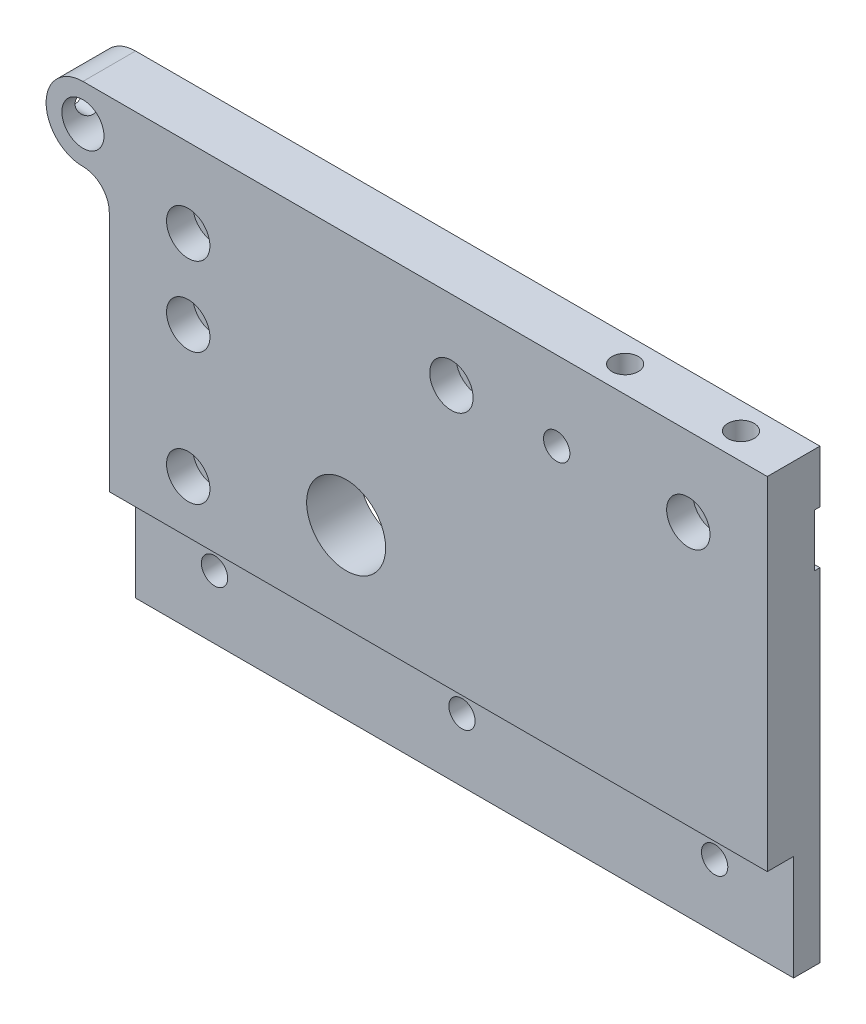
SolidWorks part; units mm, degrees
ref_plane "Front Plane" through (0, 0, 0) normal (0, 0, 1) x (1, 0, 0)
ref_plane "Top Plane" through (0, 0, 0) normal (0, 1, 0) x (1, 0, 0)
ref_plane "Right Plane" through (0, 0, 0) normal (1, 0, 0) x (0, 0, -1)
sketch "Sketch1" plane through (0, 0, 0) normal (0, 0, 1) x (1, 0, 0)
  line L0 (-743.1243, 0) -> (36413.0918, 0) construction
  line L1 (0, -743.1243) -> (0, 36413.0918) construction
  line L3 (-85.725, 53.975) -> (79.375, 53.975)
  line L4 (-79.375, 29.845) -> (-79.375, -53.975)
  line L5 (-79.375, -53.975) -> (79.375, -53.975)
  line L6 (79.375, 53.975) -> (79.375, -53.975)
  arc A0 (-85.725, 53.975) -> (-85.725, 36.195) centre (-85.725, 45.085) ccw
  circle A1 centre (-85.725, 45.085) radius 5.08
  arc A2 (-79.375, 29.845) -> (-85.725, 36.195) centre (-85.725, 29.845) ccw
  circle A3 centre (-22.225, -6.985) radius 9.525
  circle A4 centre (-60.325, -38.735) radius 3.175
  circle A5 centre (-0.635, -38.735) radius 3.175
  circle A6 centre (60.325, -38.735) radius 3.175
  dimension "D4" = 10.16
  dimension "D5" = 17.78
  dimension "D6" = 6.35
  dimension "D8" = 19.05
  dimension "D10" = 6.35
  dimension "D13" = 78.74
  dimension "D1" = 107.95
  dimension "D2" = 158.75
  dimension "D3" = 165.1
  dimension "D7" = 60.96
  dimension "D9" = 101.6
  dimension "D11" = 139.7
  dimension "D12" = 15.24
extrude "Boss-Extrude1" add sketch "Sketch1" along normal mid plane 12.7
sketch "Sketch2" plane through (0, 0, 0) normal (0, 0, 1) x (1, 0, 0)
  line L0 (79.375, -53.975) -> (79.375, 53.975) construction
  line L1 (-79.375, -53.975) -> (79.375, -53.975)
  line L2 (-79.375, -53.975) -> (-79.375, -28.575)
  line L3 (-79.375, -28.575) -> (79.375, -28.575)
  line L4 (79.375, -53.975) -> (79.375, -28.575)
  dimension "D1" = 25.4
extrude "Cut-Extrude1" cut sketch "Sketch2" along normal blind 12.7
sketch "Sketch3" plane through (0, 0, 6.35) normal (0, 0, 1) x (1, 0, 0)
  line L0 (79.375, 53.975) -> (-85.725, 53.975) construction
  line L1 (79.375, -28.575) -> (79.375, 53.975) construction
  point P0 (-60.325, 34.925)
  point P1 (-60.325, 15.875)
  point P2 (-60.325, -15.875)
  point P3 (28.575, 34.925)
  point P4 (3.175, 34.925)
  point P5 (60.325, 34.925)
  dimension "D1" = 19.05
  dimension "D2" = 38.1
  dimension "D3" = 69.85
  dimension "D4" = 31.75
  dimension "D5" = 76.2
  dimension "D6" = 50.8
  dimension "D7" = 139.7
hole_wizard "CBORE for 1/4 Pan Head Machine Screw1" positions "Sketch4" profile "Sketch5" counterbore size "1/4" standard "ANSI Inch"
sketch "Sketch4" plane through (0, 0, 6.35) normal (0, 0, 1) x (1, 0, 0)
  point P0 (-60.325, -15.875)
  point P3 (-60.325, 15.875)
  point P6 (-60.325, 34.925)
  point P9 (3.175, 34.925)
  point P12 (60.325, 34.925)
sketch "Sketch5" plane through (-60.325, -15.875, 6.35) normal (1, 0, 0) x (0, -1, 0)
  line L0 (0, 0) -> (0, 12.7)
  line L1 (0, 12.7) -> (3.3782, 12.7)
  line L3 (3.3782, 12.7) -> (3.3782, 6.35)
  line L4 (3.3782, 6.35) -> (5.2324, 6.35)
  line L5 (5.2324, 6.35) -> (5.2324, 0)
  line L7 (5.2324, 0) -> (0, 0)
  line L11 (0, -6.35) -> (0, 107.95) construction
  dimension "Thru Hole Dia." = 6.7564
  dimension "Thru Hole Depth" = 12.7
  dimension "C'Bore Dia." = 10.4648
  dimension "C'Bore Depth" = 6.35
sketch "Sketch6" plane through (0, 0, 6.35) normal (0, 0, 1) x (1, 0, 0)
  circle A0 centre (28.575, 34.925) radius 3.175
  dimension "D1" = 6.35
extrude "Cut-Extrude2" cut sketch "Sketch6" against normal blind 22.098
sketch "Sketch7" plane through (0, 0, -6.35) normal (0, 0, -1) x (-1, 0, 0)
  line L0 (-79.375, -53.975) -> (-79.375, 53.975) construction
  line L1 (-79.375, 41.275) -> (78.105, 41.275)
  line L2 (-79.375, 41.275) -> (-79.375, 28.575)
  line L3 (-79.375, 28.575) -> (78.105, 28.575)
  line L4 (78.105, 41.275) -> (78.105, 28.575)
  line L5 (-1003.175, 34.925) -> (48996.825, 34.925) construction
  point P7 (0, 0)
  point P13 (78.105, 41.275)
  dimension "D1" = 157.48
  dimension "D2" = 12.7
extrude "Cut-Extrude3" cut sketch "Sketch7" against normal blind 1.27
sketch "Sketch8" plane through (0, 53.975, 0) normal (0, 1, 0) x (1, 0, 0)
  line L0 (79.375, -6.35) -> (79.375, 6.35) construction
  circle A0 centre (66.675, 0) radius 3.175
  circle A1 centre (38.735, 0) radius 3.175
  point P6 (79.375, 0)
  dimension "D1" = 6.35
  dimension "D2" = 12.7
  dimension "D3" = 40.64
extrude "Cut-Extrude4" cut sketch "Sketch8" against normal blind 12.7
ref_plane "Plane1" through (-94.615, 0, 0) normal (-1, 0, 0) x (0, 0, 1)
sketch "Sketch9" plane through (-94.615, 0, 0) normal (-1, 0, 0) x (0, 0, 1)
  line L0 (6.35, 53.975) -> (-6.35, 53.975) construction
  circle A0 centre (0, 45.085) radius 3.175
  dimension "D1" = 6.35
  dimension "D2" = 8.89
extrude "Cut-Extrude5" cut sketch "Sketch9" against normal blind 8.89
